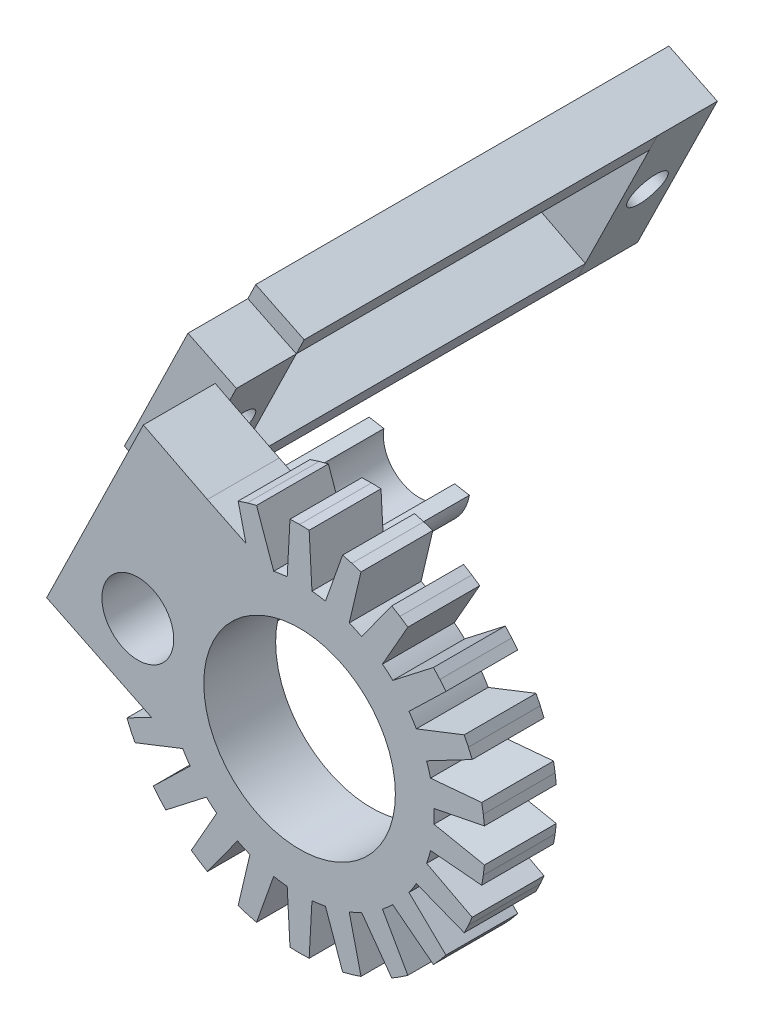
SolidWorks part; units mm, degrees
ref_plane "Front Plane" through (0, 0, 0) normal (0, 0, 1) x (1, 0, 0)
ref_plane "Top Plane" through (0, 0, 0) normal (0, 1, 0) x (1, 0, 0)
ref_plane "Right Plane" through (0, 0, 0) normal (1, 0, 0) x (0, 0, -1)
sketch "Sketch2" plane through (0, 0, 0) normal (0, 0, 1) x (1, 0, 0)
  line L0 (0, 54.7493) -> (0, -47.1271) construction
  line L1 (-15.3422, -2.2059) -> (-15.7273, -2.9945)
  line L2 (0, 15.5) -> (-0.7997, 15.4794)
  line L3 (0, 15.5) -> (0.7997, 15.4794)
  line L5 (-15.7273, -2.9945) -> (-21.1189, -0.362)
  line L6 (1.0339, 11.1923) -> (0.7997, 15.4794)
  line L7 (-1.0339, 11.1923) -> (-0.7997, 15.4794)
  line L8 (4.1453, 10.4477) -> (5.1284, 14.627)
  line L9 (2.1612, 11.0303) -> (3.5937, 15.0776)
  line L10 (4.3669, 14.8721) -> (3.5937, 15.0776)
  line L11 (4.3669, 14.8721) -> (5.1284, 14.627)
  line L12 (6.9208, 8.8566) -> (9.0415, 12.5897)
  line L13 (5.1813, 9.9746) -> (7.696, 13.4544)
  line L14 (8.3799, 13.0394) -> (7.696, 13.4544)
  line L15 (8.3799, 13.0394) -> (9.0415, 12.5897)
  line L16 (9.1357, 6.5481) -> (12.2222, 9.5324)
  line L17 (7.7815, 8.1108) -> (11.1748, 10.7412)
  line L18 (11.7141, 10.1503) -> (11.1748, 10.7412)
  line L19 (11.7141, 10.1503) -> (12.2222, 9.5324)
  line L20 (10.6104, 3.709) -> (14.4127, 5.7029)
  line L21 (9.7514, 5.5899) -> (13.7483, 7.1578)
  line L22 (14.0993, 6.4389) -> (13.7483, 7.1578)
  line L23 (14.0993, 6.4389) -> (14.4127, 5.7029)
  line L24 (11.2256, 0.5695) -> (15.4356, 1.4113)
  line L25 (10.9313, 2.6162) -> (15.208, 2.9945)
  line L26 (15.3422, 2.2059) -> (15.208, 2.9945)
  line L27 (15.3422, 2.2059) -> (15.4356, 1.4113)
  line L28 (10.9313, -2.6162) -> (15.208, -2.9945)
  line L29 (11.2256, -0.5695) -> (15.4356, -1.4113)
  line L30 (15.3422, -2.2059) -> (15.4356, -1.4113)
  line L31 (15.3422, -2.2059) -> (15.208, -2.9945)
  line L32 (9.7514, -5.5899) -> (13.7483, -7.1578)
  line L33 (10.6104, -3.709) -> (14.4127, -5.7029)
  line L34 (14.0993, -6.4389) -> (14.4127, -5.7029)
  line L35 (14.0993, -6.4389) -> (13.7483, -7.1578)
  line L36 (7.7815, -8.1108) -> (11.1748, -10.7412)
  line L37 (9.1357, -6.5481) -> (12.2222, -9.5324)
  line L38 (11.7141, -10.1503) -> (12.2222, -9.5324)
  line L39 (11.7141, -10.1503) -> (11.1748, -10.7412)
  line L40 (5.1813, -9.9746) -> (7.696, -13.4544)
  line L41 (6.9208, -8.8566) -> (9.0415, -12.5897)
  line L42 (8.3799, -13.0394) -> (9.0415, -12.5897)
  line L43 (8.3799, -13.0394) -> (7.696, -13.4544)
  line L44 (2.1612, -11.0303) -> (3.5937, -15.0776)
  line L45 (4.1453, -10.4477) -> (5.1284, -14.627)
  line L46 (4.3669, -14.8721) -> (5.1284, -14.627)
  line L47 (4.3669, -14.8721) -> (3.5937, -15.0776)
  line L48 (-1.0339, -11.1923) -> (-0.7997, -15.4794)
  line L49 (1.0339, -11.1923) -> (0.7997, -15.4794)
  line L50 (0, -15.5) -> (0.7997, -15.4794)
  line L51 (0, -15.5) -> (-0.7997, -15.4794)
  line L52 (-4.1453, -10.4477) -> (-5.1284, -14.627)
  line L53 (-2.1612, -11.0303) -> (-3.5937, -15.0776)
  line L54 (-4.3669, -14.8721) -> (-3.5937, -15.0776)
  line L55 (-4.3669, -14.8721) -> (-5.1284, -14.627)
  line L56 (-6.9208, -8.8566) -> (-9.0415, -12.5897)
  line L57 (-5.1813, -9.9746) -> (-7.696, -13.4544)
  line L58 (-8.3799, -13.0394) -> (-7.696, -13.4544)
  line L59 (-8.3799, -13.0394) -> (-9.0415, -12.5897)
  line L60 (-9.1357, -6.5481) -> (-12.2222, -9.5324)
  line L61 (-7.7815, -8.1108) -> (-11.1748, -10.7412)
  line L62 (-11.7141, -10.1503) -> (-11.1748, -10.7412)
  line L63 (-11.7141, -10.1503) -> (-12.2222, -9.5324)
  line L64 (-12.372, -4.6328) -> (-14.4127, -5.7029)
  line L65 (-9.7514, -5.5899) -> (-13.7483, -7.1578)
  line L66 (-14.0993, -6.4389) -> (-13.7483, -7.1578)
  line L67 (-14.0993, -6.4389) -> (-14.4127, -5.7029)
  line L68 (-15.7273, -2.9945) -> (-15.208, -2.9945)
  line L70 (-15.7273, -2.9945) -> (-12.372, -4.6328)
  line L71 (-7.696, 13.4544) -> (-13.0447, 16.1732)
  line L72 (-7.696, 13.4544) -> (-4.4836, 11.886)
  line L74 (-13.0447, 16.1732) -> (-21.1189, -0.362)
  line L88 (-2.1612, 11.0303) -> (-3.5937, 15.0776)
  line L89 (-4.4836, 11.886) -> (-5.1284, 14.627)
  line L90 (-4.3669, 14.8721) -> (-5.1284, 14.627)
  line L91 (-4.3669, 14.8721) -> (-3.5937, 15.0776)
  circle A1 centre (0, 0) radius 8
  arc A7 (-9.7514, -5.5899) -> (-9.1357, -6.5481) centre (0, 0) ccw
  arc A8 (-7.7815, -8.1108) -> (-6.9208, -8.8566) centre (0, 0) ccw
  arc A9 (-5.1813, -9.9746) -> (-4.1453, -10.4477) centre (0, 0) ccw
  arc A10 (-2.1612, -11.0303) -> (-1.0339, -11.1923) centre (0, 0) ccw
  arc A11 (1.0339, -11.1923) -> (2.1612, -11.0303) centre (0, 0) ccw
  arc A12 (4.1453, -10.4477) -> (5.1813, -9.9746) centre (0, 0) ccw
  arc A13 (6.9208, -8.8566) -> (7.7815, -8.1108) centre (0, 0) ccw
  arc A14 (9.1357, -6.5481) -> (9.7514, -5.5899) centre (0, 0) ccw
  arc A15 (10.6104, -3.709) -> (10.9313, -2.6162) centre (0, 0) ccw
  arc A16 (11.2256, -0.5695) -> (11.2256, 0.5695) centre (0, 0) ccw
  arc A17 (10.9313, 2.6162) -> (10.6104, 3.709) centre (0, 0) ccw
  arc A18 (9.7514, 5.5899) -> (9.1357, 6.5481) centre (0, 0) ccw
  arc A19 (7.7815, 8.1108) -> (6.9208, 8.8566) centre (0, 0) ccw
  arc A20 (5.1813, 9.9746) -> (4.1453, 10.4477) centre (0, 0) ccw
  arc A21 (2.1612, 11.0303) -> (1.0339, 11.1923) centre (0, 0) ccw
  arc A23 (-1.0339, 11.1923) -> (-2.1612, 11.0303) centre (0, 0) ccw
  point P121 (0, 0)
  dimension "D1" = 6
  dimension "D2" = 16
  dimension "D5" = 1.5995
  dimension "D6" = 4.2934
  dimension "D7" = 6
extrude "Boss-Extrude1" add sketch "Sketch2" along normal blind 6
sketch "Sketch3" plane through (0, 0, 0) normal (0, 0, -1) x (-1, 0, 0)
  circle A1 centre (13.506, 1.933) radius 3
extrude "Cut-Extrude2" cut sketch "Sketch3" against normal blind 6
sketch "Sketch4" plane through (0, 0, 0) normal (0, 0, -1) x (-1, 0, 0)
  circle A0 centre (13.506, 1.933) radius 3
  circle A1 centre (13.506, 1.933) radius 4.25
extrude "Boss-Extrude2" add sketch "Sketch4" along normal blind 3.5
sketch "Sketch5" plane through (0, 0, -3.5) normal (0, 0, -1) x (-1, 0, 0)
  line L0 (17.6922, 2.6669) -> (16.461, 2.451)
  line L1 (10.5511, 1.4149) -> (9.3199, 1.199)
  arc A0 (10.5511, 1.4149) -> (16.461, 2.451) centre (13.506, 1.933) ccw
  arc A1 (9.3199, 1.199) -> (17.6922, 2.6669) centre (13.506, 1.933) ccw
extrude "Boss-Extrude3" add sketch "Sketch5" along normal blind 14
sketch "Sketch6" plane through (0, 0, 0) normal (0, 0, -1) x (-1, 0, 0)
  line L0 (19.6989, 9.6794) -> (20.6342, 7.8548)
  line L3 (19.6989, 9.6794) -> (15.3175, 18.6685)
  line L4 (15.3175, 18.6685) -> (11.2724, 16.6968)
  line L5 (11.2724, 16.6968) -> (15.6538, 7.7078)
  line L6 (20.6342, 7.8548) -> (16.6292, 5.8019)
  line L7 (16.6292, 5.8019) -> (15.6538, 7.7078)
  dimension "D1" = 10
  dimension "D2" = 4.5
extrude "Boss-Extrude4" add sketch "Sketch6" along normal blind 5
sketch "Sketch7" plane through (-19.7296, 9.6165, 0) normal (-0.8989, 0.4381, 0) x (0, 0, 1)
  circle A0 centre (-2.5, 4.07) radius 1.6
  dimension "D1" = 3.2
extrude "Cut-Extrude3" cut sketch "Sketch7" against normal blind 10
sketch "Sketch9" plane through (0, 0, -5) normal (0, 0, -1) x (-1, 0, 0)
  line L0 (20.6342, 7.8548) -> (21.3074, 6.5144)
  line L1 (21.3074, 6.5144) -> (17.2861, 4.4947)
  line L2 (17.2861, 4.4947) -> (16.6295, 5.802)
  line L4 (16.6295, 5.802) -> (20.6342, 7.8548)
  line L5 (15.3175, 18.6685) -> (14.6603, 20.0168)
  line L6 (14.6603, 20.0168) -> (10.6152, 18.0452)
  line L7 (10.6152, 18.0452) -> (11.2724, 16.6968)
extrude "Boss-Extrude6" add sketch "Sketch9" along normal blind 29.5 separate body contours L6 L7 L5 M5 | L2 L1 L0 M2
sketch "Sketch10" plane through (0, 0, -34.5) normal (0, 0, -1) x (-1, 0, 0)
  line L0 (14.6603, 20.0168) -> (21.2503, 6.6282)
  line L1 (20.6342, 7.8548) -> (21.3074, 6.5144) construction
  line L2 (21.2503, 6.6282) -> (17.2861, 4.4947)
  line L3 (17.2861, 4.4947) -> (10.6152, 18.0452)
  line L4 (10.6152, 18.0452) -> (14.6603, 20.0168)
extrude "Boss-Extrude7" add sketch "Sketch10" along normal blind 5
sketch "Sketch11" plane through (-15.695, 7.7267, 0) normal (0.8972, -0.4417, 0) x (0, 0, -1)
  circle A0 centre (37, 3.9402) radius 1.6
  point P8 (0, 0)
extrude "Cut-Extrude4" cut sketch "Sketch11" against normal blind 5
